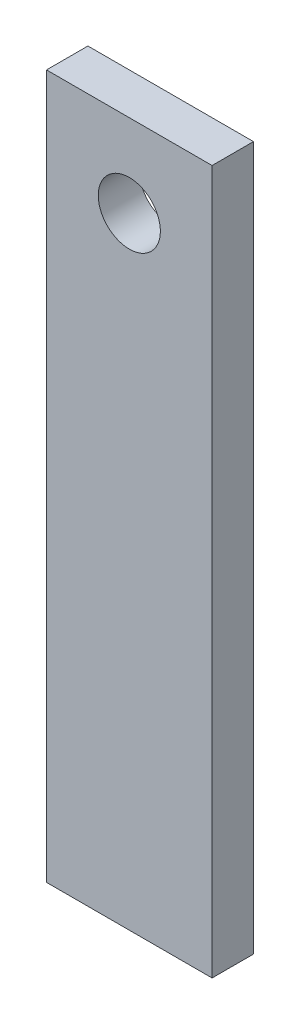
SolidWorks part; units mm, degrees
ref_plane "Front Plane" through (0, 0, 0) normal (0, 0, 1) x (1, 0, 0)
ref_plane "Top Plane" through (0, 0, 0) normal (0, 1, 0) x (1, 0, 0)
ref_plane "Right Plane" through (0, 0, 0) normal (1, 0, 0) x (0, 0, -1)
sketch "Sketch1" plane through (0, 0, 0) normal (0, 0, 1) x (1, 0, 0)
  line L0 (0, 0) -> (-50000, 0) construction
  line L1 (-38.1, 38.1) -> (38.1, 38.1)
  line L2 (-38.1, 38.1) -> (-38.1, -285.75)
  line L3 (-38.1, -285.75) -> (38.1, -285.75)
  line L4 (38.1, 38.1) -> (38.1, -285.75)
  circle A0 centre (0, 0) radius 14.2875
  dimension "D5" = 28.575
  dimension "D1" = 38.1
  dimension "D2" = 76.2
  dimension "D3" = 38.1
  dimension "D4" = 285.75
extrude "Boss-Extrude1" add sketch "Sketch1" along normal mid plane 19.05
